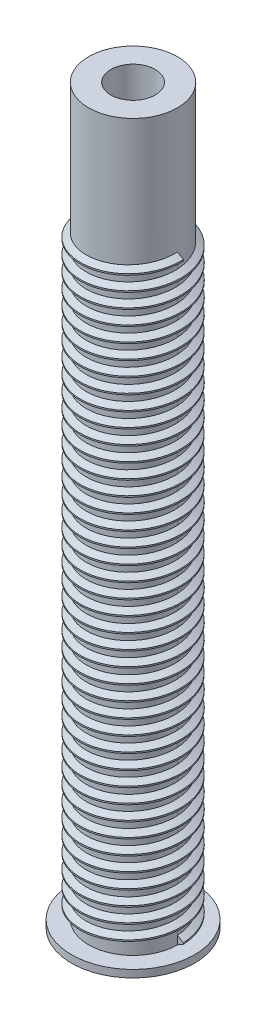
SolidWorks part; units mm, degrees
ref_plane "Front Plane" through (0, 0, 0) normal (0, 0, 1) x (1, 0, 0)
ref_plane "Top Plane" through (0, 0, 0) normal (0, 1, 0) x (1, 0, 0)
ref_plane "Right Plane" through (0, 0, 0) normal (1, 0, 0) x (0, 0, -1)
sketch "Sketch1" plane through (0, 0, 0) normal (0, 1, 0) x (1, 0, 0)
  circle A0 centre (0, 0) radius 6
  dimension "D1" = 12
extrude "Boss-Extrude1" add sketch "Sketch1" along normal blind 98
thread "Thread1" pitch 1.5 start angle 0, offset 0, length 80, pitch 2, diameter 12
ref_plane "Plane1" through (6, 0, 0) normal (0, 0, 1) x (1, 0, 0)
sketch "Thread Profile1" plane through (6, 0, 0) normal (0, 0, 1) x (1, 0, 0)
  line L0 (0, 0) -> (0, 1.5) construction
  line L1 (0, 0) -> (0.8119, 0.4687)
  line L2 (0.8119, 0.4687) -> (0.8119, 0.6562)
  line L3 (0.8119, 0.6562) -> (0, 1.125)
  line L4 (0.8119, 0.5625) -> (0, 0.5625) construction
  line L11 (0, 0) -> (0, 1.125)
  point P2 (0, 0)
  dimension "Pitch" = 1.5
  dimension "Profile_Angle" = 60
  dimension "Profile_Land" = 0.1875
  dimension "Profile_Height" = 0.8119
sketch "Sketch4" plane through (0, 98, 0) normal (0, 1, 0) x (1, 0, 0)
  circle A0 centre (0, 0) radius 3
  dimension "D1" = 6
extrude "Cut-Extrude1" cut sketch "Sketch4" against normal blind 19
sketch "Sketch5" plane through (0, 0, 0) normal (0, -1, 0) x (1, 0, 0)
  circle A0 centre (0, 0) radius 8.3156
extrude "Boss-Extrude2" add sketch "Sketch5" along normal blind 1
